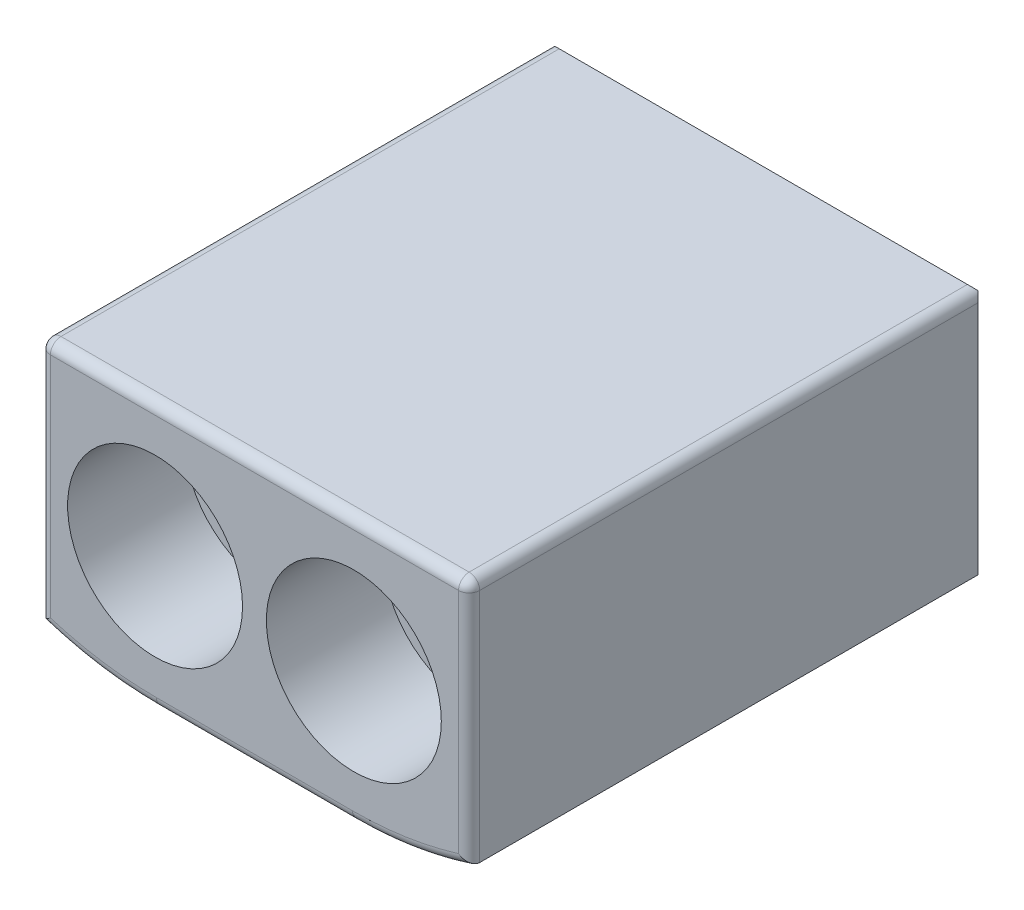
SolidWorks part; units mm, degrees
ref_plane "Front Plane" through (0, 0, 0) normal (0, 0, 1) x (1, 0, 0)
ref_plane "Top Plane" through (0, 0, 0) normal (0, 1, 0) x (1, 0, 0)
ref_plane "Right Plane" through (0, 0, 0) normal (1, 0, 0) x (0, 0, -1)
sketch "Sketch1" plane through (0, 0, 0) normal (0, 0, 1) x (1, 0, 0)
  line L0 (0, -12.7) -> (0, 0) construction
  line L1 (-4.699, -12.7) -> (4.699, -12.7)
  line L2 (-10.287, -11.7991) -> (-10.287, 0)
  line L3 (-10.287, 0) -> (10.287, 0)
  line L4 (10.287, -11.7991) -> (10.287, 0)
  line L5 (0, 0) -> (0, -12.7) construction
  arc A1 (4.699, -12.7) -> (10.287, -11.7991) centre (4.699, 5.08) ccw
  arc A2 (-4.699, -12.7) -> (-10.287, -11.7991) centre (-4.699, 5.08) cw
  dimension "D4" = 5.588
  dimension "D5" = 17.78
  dimension "D1" = 12.7
  dimension "D2" = 10.287
  dimension "D3" = 17.78
  dimension "D7" = 5.588
extrude "Boss-Extrude1" add sketch "Sketch1" against normal blind 25.4
sketch "Sketch3" plane through (0, 0, 0) normal (0, 0, 1) x (1, 0, 0)
  line L0 (-4.699, -12.7) -> (4.699, -12.7) construction
  line L1 (0, 0) -> (0, -18.1399) construction
  line L3 (10.287, 0) -> (-10.287, 0) construction
  line L4 (-10.287, 0) -> (-10.287, -11.7991) construction
  circle A0 centre (4.7625, -6.35) radius 2.794
  circle A1 centre (-4.7625, -6.35) radius 2.794
  dimension "D1" = 5.588
  dimension "D3" = 5.588
  dimension "D2" = 6.35
  dimension "D5" = 9.525
  dimension "D6" = 5.5245
extrude "Cut-Extrude1" cut sketch "Sketch3" against normal through all
sketch "Sketch4" plane through (0, 0, 0) normal (0, 0, 1) x (1, 0, 0)
  circle A0 centre (4.7625, -6.35) radius 4.191
  circle A1 centre (-4.7625, -6.35) radius 4.191
  dimension "D1" = 8.382
  dimension "D2" = 8.382
extrude "Cut-Extrude2" cut sketch "Sketch4" against normal blind 5.588
chamfer "Chamfer3" distance 1.016 angle 45 6 edges at (10.287, -5.8995, -25.4) (0, -12.7, -25.4) (-7.5291, -12.4733, -25.4) (-10.287, -5.8995, -25.4) (0, 0, -25.4) (7.5291, -12.4733, -25.4)
fillet "Fillet3" radius 0.508 8 edges at (-10.287, -5.8995, 0) (-7.5291, -12.4733, 0) (0, -12.7, 0) (10.287, -5.8995, 0) (0, 0, 0) (10.287, 0, -12.192) (-10.287, 0, -12.192) (7.5291, -12.4733, 0)
